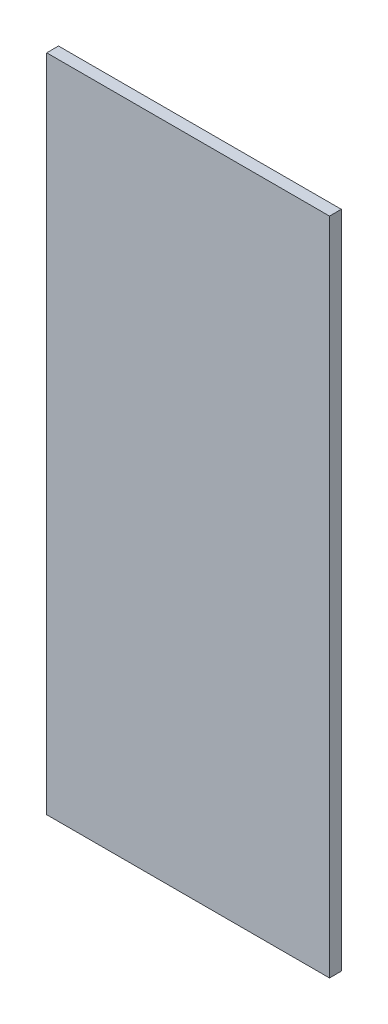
SolidWorks part; units mm, degrees
ref_plane "Front Plane" through (0, 0, 0) normal (0, 0, 1) x (1, 0, 0)
ref_plane "Top Plane" through (0, 0, 0) normal (0, 1, 0) x (1, 0, 0)
ref_plane "Right Plane" through (0, 0, 0) normal (1, 0, 0) x (0, 0, -1)
sketch "Sketch1" plane through (0, 0, 0) normal (0, 0, 1) x (1, 0, 0)
  line L1 (0, 0) -> (457.2, 0)
  line L2 (0, 0) -> (0, 1066.8)
  line L3 (0, 1066.8) -> (457.2, 1066.8)
  line L4 (457.2, 0) -> (457.2, 1066.8)
  dimension "D1" = 1066.8
  dimension "D2" = 457.2
extrude "Extrude1" add sketch "Sketch1" along normal blind 19.05
